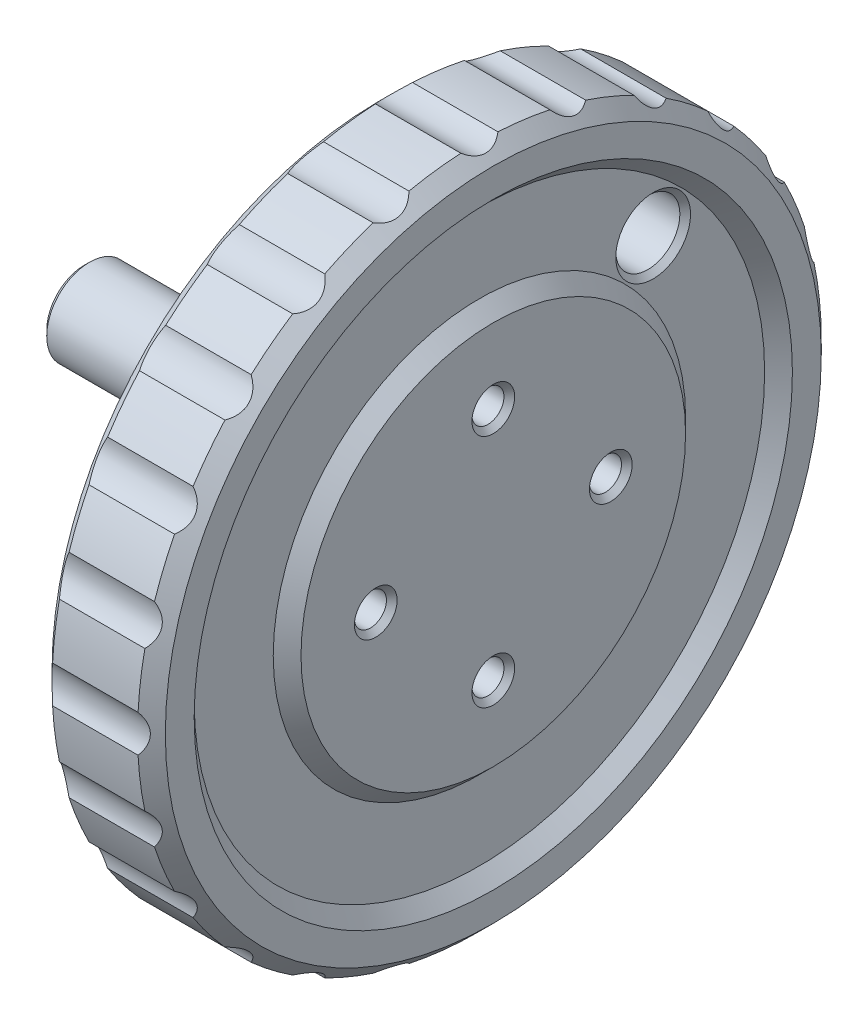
SolidWorks part; units mm, degrees
ref_plane "Front Plane" through (0, 0, 0) normal (0, 0, 1) x (1, 0, 0)
ref_plane "Top Plane" through (0, 0, 0) normal (0, 1, 0) x (1, 0, 0)
ref_plane "Right Plane" through (0, 0, 0) normal (1, 0, 0) x (0, 0, -1)
sketch "Sketch1" plane through (0, 0, 0) normal (0, 0, 1) x (1, 0, 0)
  line L0 (749.3302, 0) -> (872.1832, 0) construction
  line L2 (606.425, 12.7) -> (711.2, 12.7)
  line L3 (709.6125, 12.7) -> (503.2375, 12.7) construction
  line L5 (711.2, 12.7) -> (711.2, 44.45)
  line L6 (711.2, 44.45) -> (698.5, 44.45)
  line L7 (698.5, 44.45) -> (694.3725, 48.5775)
  line L8 (694.3725, 48.5775) -> (694.3725, 57.15)
  line L9 (694.3725, 57.15) -> (698.5, 61.2775)
  line L10 (698.5, 61.2775) -> (698.5, 84.7725)
  line L11 (698.5, 84.7725) -> (694.3725, 88.9)
  line L12 (694.3725, 88.9) -> (694.3725, 97.4725)
  line L13 (694.3725, 97.4725) -> (698.5, 101.6)
  line L14 (698.5, 101.6) -> (723.9, 101.6)
  line L16 (711.2, 139.678) -> (711.2, 44.45) construction
  line L17 (728.0275, 97.4725) -> (723.9, 101.6)
  line L18 (728.0275, 88.9) -> (728.0275, 97.4725)
  line L19 (723.9, 84.7725) -> (728.0275, 88.9)
  line L20 (723.9, 61.2775) -> (723.9, 84.7725)
  line L21 (728.0275, 57.15) -> (723.9, 61.2775)
  line L22 (728.0275, 0) -> (728.0275, 57.15)
  line L23 (711.2, -42.8625) -> (711.2, 42.8625) construction
  line L24 (606.425, 12.7) -> (606.425, 0)
  line L25 (606.425, 0) -> (728.0275, 0)
  line L26 (709.6125, 44.45) -> (700.0875, 44.45) construction
  point P25 (711.2, 101.6)
  dimension "D1" = 25.4
  dimension "D2" = 101.6
  dimension "D3" = 33.655
  dimension "D4" = 135
  dimension "D5" = 57.15
revolve "Revolve1" add sketch "Sketch1" angle 360 about L0
sketch "Sketch2" plane through (728.0275, 0, 0) normal (1, 0, 0) x (0, 0, -1)
  circle A1 centre (-34.925, 0) radius 4.7625
  circle A2 centre (-34.925, 0) radius 4.7625
  circle A3 centre (0, -34.925) radius 4.7625
  circle A4 centre (0, -34.925) radius 4.7625
  circle A5 centre (34.925, 0) radius 4.7625
  circle A6 centre (34.925, 0) radius 4.7625
  circle A7 centre (0, 34.925) radius 4.7625
  circle A8 centre (0, 34.925) radius 4.7625
  dimension "D1" = 0
  dimension "D2" = 0
  dimension "D3" = 0
  dimension "D4" = 0
extrude "Cut-Extrude1" cut sketch "Sketch2" against normal through all
sketch "Sketch3" plane through (728.0275, 0, 0) normal (1, 0, 0) x (0, 0, -1)
  circle A0 centre (0, 109.22) radius 9.525
  circle A1 centre (0, 0) radius 101.6 construction
  dimension "D1" = 19.05
  dimension "D2" = 7.62
extrude "Cut-Extrude2" cut sketch "Sketch3" against normal through all
pattern_circular "CirPattern1" count 60 every 15 about axis through (0, 0, 0) along (1, 0, 0) of "Cut-Extrude2"
sketch "Sketch4" plane through (723.9, 0, 0) normal (1, 0, 0) x (0, 0, -1)
  line L0 (0, 0) -> (51.6365, 51.6365) construction
  line L1 (0, 0) -> (0, 73.025) construction
  circle A0 centre (51.6365, 51.6365) radius 9.525
  circle A1 centre (0, 0) radius 73.025 construction
  dimension "D1" = 19.05
  dimension "D3" = 146.05
  dimension "D2" = 45
extrude "Cut-Extrude3" cut sketch "Sketch4" against normal through all
chamfer "Chamfer1" distance 1.5875 angle 45 11 edges at (698.5, 51.6365, -61.1615) (723.9, 51.6365, -61.1615) (711.2, 0, 30.1625) (728.0275, 0, 30.1625) (711.2, -34.925, -4.7625) (728.0275, -34.925, -4.7625) (711.2, 0, -39.6875) (728.0275, 0, -39.6875) (711.2, 34.925, -4.7625) (728.0275, 34.925, -4.7625) (606.425, 0, 12.7)
